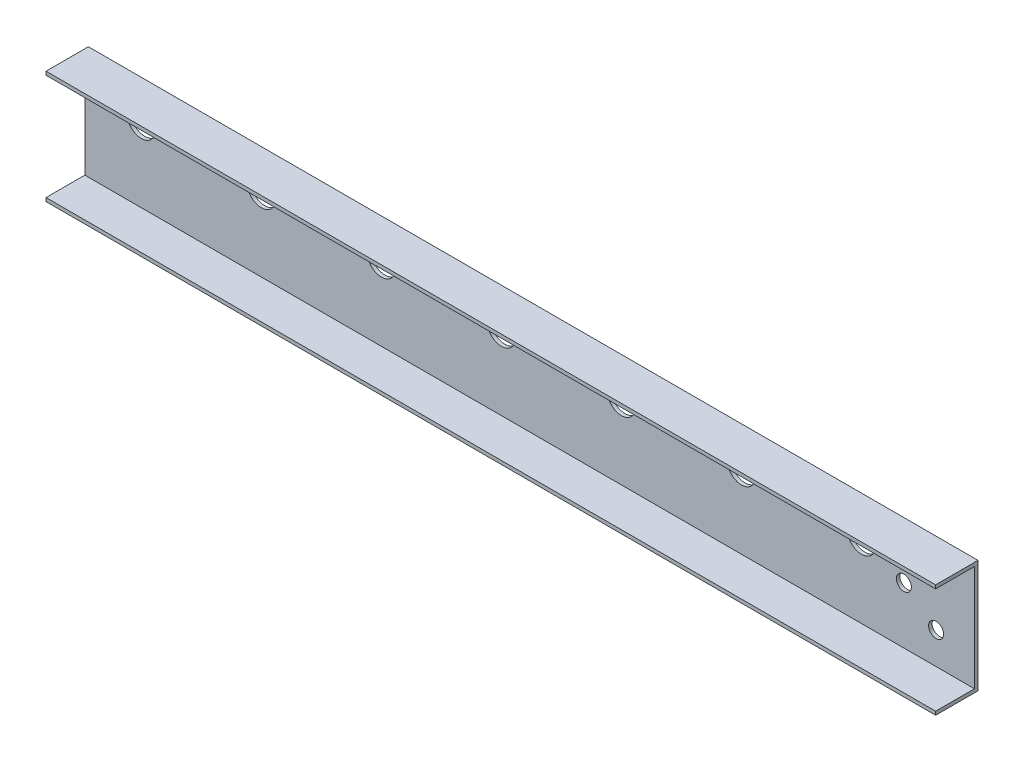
SolidWorks part; units mm, degrees
ref_plane "Plane1" through (0, 0, 0) normal (0, 0, 1) x (1, 0, 0)
ref_plane "Plane2" through (0, 0, 0) normal (0, 1, 0) x (1, 0, 0)
ref_plane "Plane3" through (0, 0, 0) normal (1, 0, 0) x (0, 0, -1)
sketch "Sketch1" plane through (0, 0, 0) normal (1, 0, 0) x (0, 0, -1)
  line L0 (0, 0) -> (0, -101.6)
  line L1 (0, -101.6) -> (-38.1, -101.6)
  line L2 (0, 0) -> (-38.1, 0)
  line L3 (-38.1, -101.6) -> (-38.1, 0) construction
  dimension "D1" = 38.1
  dimension "D2" = 101.6
extrude "Base-Extrude-Thin" add sketch "Sketch1" along normal blind 800.1 thin
sketch "Sketch2" plane through (0, 0, 0) normal (0, 0, -1) x (-1, 0, 0)
  line L0 (0, 0) -> (0, -101.6) construction
  line L1 (-800.1, 0) -> (0, 0) construction
  circle A0 centre (-50.8, -31.75) radius 12.7
  dimension "D1" = 25.4
  dimension "D2" = 50.8
  dimension "D3" = 31.75
extrude "Cut-Extrude1" cut sketch "Sketch2" against normal through all
pattern_linear "LPattern1" count 7 spacing 107.95 along (1, 0, 0) of "Cut-Extrude1"
sketch "Sketch3" plane through (0, 0, 3.175) normal (0, 0, 1) x (1, 0, 0)
  line L0 (800.1, 0) -> (800.1, -101.6) construction
  line L1 (800.1, 0) -> (0, 0) construction
  line L2 (736.6, -47.625) -> (780.218, -47.625) construction
  circle A3 centre (765.5642, -69.85) radius 6.7437
  circle A4 centre (765.5642, -25.4) radius 6.7437
  circle A5 centre (736.6, -47.625) radius 6.7437
  dimension "D2" = 63.5
  dimension "D3" = 13.4874
  dimension "D5" = 44.45
  dimension "D1" = 34.5358
  dimension "D4" = 47.625
extrude "Cut-Extrude2" cut sketch "Sketch3" against normal through all
